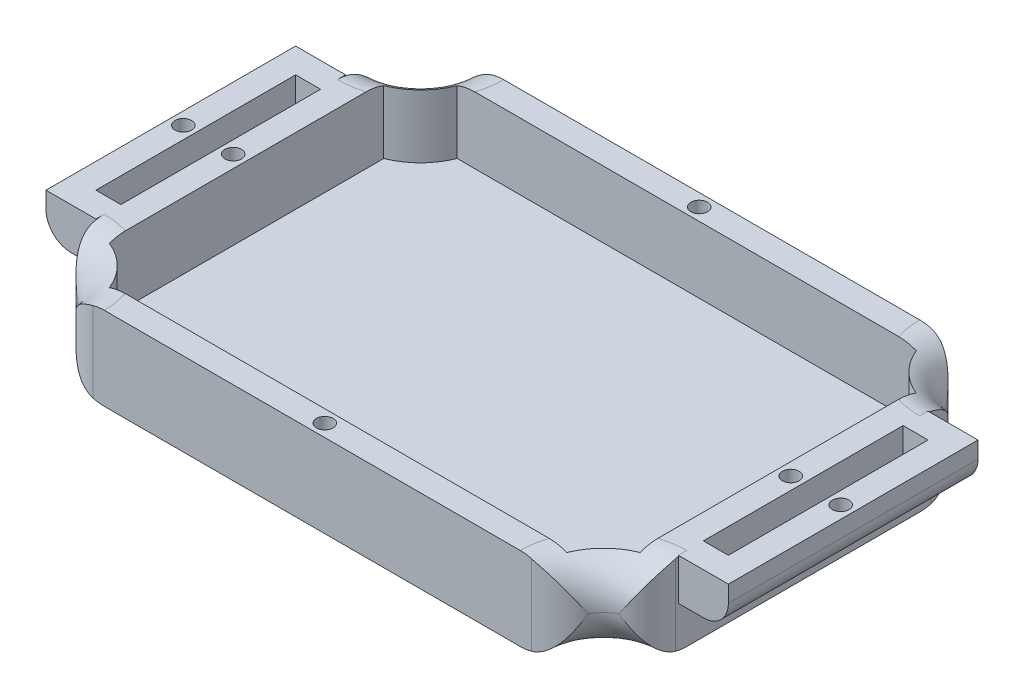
SolidWorks part; units mm, degrees
ref_plane "Front Plane" through (0, 0, 0) normal (0, 0, 1) x (1, 0, 0)
ref_plane "Top Plane" through (0, 0, 0) normal (0, 1, 0) x (1, 0, 0)
ref_plane "Right Plane" through (0, 0, 0) normal (1, 0, 0) x (0, 0, -1)
sketch "Sketch1" plane through (0, 0, 0) normal (0, 1, 0) x (1, 0, 0)
  line L1 (30, 24) -> (-30, 24)
  line L2 (35, 19) -> (35, -19)
  line L3 (30, -24) -> (-30, -24)
  line L4 (-35, 19) -> (-35, -19)
  line L5 (35, 24) -> (-35, -24) construction
  line L6 (35, -24) -> (-35, 24) construction
  arc A0 (-35, 19) -> (-30, 24) centre (-35, 24) ccw
  arc A1 (30, 24) -> (35, 19) centre (35, 24) ccw
  arc A2 (-30, -24) -> (-35, -19) centre (-35, -24) ccw
  arc A3 (35, -19) -> (30, -24) centre (35, -24) ccw
  point P0 (0, 0)
  dimension "D1" = 70
  dimension "D2" = 48
extrude "Boss-Extrude1" add sketch "Sketch1" along normal blind 10
sketch "Sketch2" plane through (0, 10, 0) normal (0, 1, 0) x (1, 0, 0)
  line L0 (-27.5838, 21) -> (27.5838, 21)
  line L1 (32, 16.5838) -> (32, -16.5838)
  line L2 (-27.3874, -21) -> (27.5838, -21)
  line L3 (-32, 16.5838) -> (-32, -16.3874)
  line L4 (30, 24) -> (-30, 24) construction
  line L5 (-35, 19) -> (-35, -19) construction
  line L6 (35, -19) -> (35, 19) construction
  line L7 (-30, -24) -> (30, -24) construction
  arc A0 (-32, 16.5838) -> (-27.5838, 21) centre (-35, 24) ccw
  arc A1 (-27.3874, -21) -> (-32, -16.3874) centre (-35, -24) ccw
  arc A2 (27.5838, 21) -> (32, 16.5838) centre (35, 24) ccw
  arc A3 (32, -16.5838) -> (27.5838, -21) centre (35, -24) ccw
  arc A4 (-30, -24) -> (-35, -19) centre (-35, -24) ccw construction
  arc A5 (-35, 19) -> (-30, 24) centre (-35, 24) ccw construction
  arc A6 (30, 24) -> (35, 19) centre (35, 24) ccw construction
  arc A7 (35, -19) -> (30, -24) centre (35, -24) ccw construction
  dimension "D1" = 3
  dimension "D2" = 3
  dimension "D3" = 3
  dimension "D4" = 3
extrude "Cut-Extrude1" cut sketch "Sketch2" against normal blind 8
fillet "Fillet1" radius 5 16 edges at (35, 5, -19) (31.4645, 10, -20.4645) (30, 5, -24) (31.4645, 0, -20.4645) (-30, 5, -24) (-31.4645, 10, -20.4645) (-35, 5, -19) (-31.4645, 0, -20.4645) (30, 5, 24) (31.4645, 10, 20.4645) (35, 5, 19) (31.4645, 0, 20.4645) (-35, 5, 19) (-31.4645, 10, 20.4645) (-30, 5, 24) (-31.4645, 0, 20.4645)
sketch "Sketch3" plane through (0, 10, 0) normal (0, 1, 0) x (1, 0, 0)
  line L0 (0, 0) -> (-43.0713, 0) construction
  line L1 (0, 0) -> (48.1157, 0) construction
  line L2 (-33.5, 5.6911) -> (-33.5, -7.6312) construction
  line L3 (33.5, 5.6911) -> (33.5, -7.6312) construction
  line L4 (0, 0) -> (0, -29.4902) construction
  line L5 (0, 0) -> (0, 28.1968) construction
  line L6 (-4.527, 22.5) -> (5.3031, 22.5) construction
  line L7 (-4.527, -22.5) -> (6.9845, -22.5) construction
  line L8 (-35, 14) -> (-35, -14) construction
  line L9 (25, 24) -> (-25, 24) construction
  line L12 (32, -16.5838) -> (32, 16.5838) construction
  line L13 (-27.3874, -21) -> (27.5838, -21) construction
  circle A0 centre (-33.5, 0) radius 1
  circle A1 centre (0, 22.5) radius 1
  circle A2 centre (33.5, 0) radius 1
  circle A3 centre (0, -22.5) radius 1
  dimension "D1" = 1.5
  dimension "D2" = 1.5
  dimension "D3" = 1.5
  dimension "D4" = 1.5
extrude "Cut-Extrude2" cut sketch "Sketch3" against normal blind 5
sketch "Sketch4" plane through (0, 10, 0) normal (0, 1, 0) x (1, 0, 0)
  line L0 (35, -14) -> (35, 14) construction
  line L4 (35, 15) -> (35, 12)
  line L5 (35, 12) -> (35, 0)
  line L7 (-35, 14) -> (-35, -14) construction
  line L8 (-35, 15) -> (-41, 15)
  line L9 (-35, 15) -> (-35, -15)
  line L10 (-35, -15) -> (-41, -15)
  line L11 (-41, 15) -> (-41, -15)
  line L12 (-35, 15) -> (-41, -15) construction
  line L13 (-35, -15) -> (-41, 15) construction
  line L14 (0, 0) -> (-43.9534, 0) construction
  line L15 (0, 0) -> (53.124, 0) construction
  line L20 (35, 0) -> (35, -15)
  line L21 (41, 15) -> (35, 15)
  line L23 (-35, 12) -> (-38, 12)
  line L24 (-35, 12) -> (-35, -12)
  line L25 (-35, -12) -> (-38, -12)
  line L26 (-38, 12) -> (-38, -12)
  line L27 (-35, 12) -> (-38, -12) construction
  line L28 (-35, -12) -> (-38, 12) construction
  line L29 (41, 15) -> (41, -15)
  line L30 (41, -15) -> (35, -15)
  line L31 (35, 15) -> (35, -15)
  line L32 (41, 15) -> (35, -15) construction
  line L33 (41, -15) -> (35, 15) construction
  line L34 (35, 12) -> (38, 12)
  line L35 (35, 12) -> (35, -12)
  line L36 (35, -12) -> (38, -12)
  line L37 (38, 12) -> (38, -12)
  point P0 (38, 0)
  point P2 (38, 0)
  point P7 (-38, 0)
  point P14 (-38, 15)
  point P19 (38, 0)
  point P24 (-36.5, 0)
  point P29 (36.6175, 0)
  point P35 (38, 15)
  dimension "D1" = 6
  dimension "D2" = 30
  dimension "D3" = 3
  dimension "D4" = 3
  dimension "D5" = 15
  dimension "D6" = 15
  dimension "D7" = 3
  dimension "D8" = 6
  dimension "D9" = 3
  dimension "D10" = 0
  dimension "D11" = 3
extrude "Boss-Extrude2" add sketch "Sketch4" against normal blind 5 contours L26 L23 L9 L8 L11 L10 L25 | L34 L37 L36 L20 L30 L29 L21 L4 M30
sketch "Sketch5" plane through (0, 10, 0) normal (0, 1, 0) x (1, 0, 0)
  line L0 (0, 0) -> (-50.0004, 0) construction
  line L1 (-39.5, 7.2728) -> (-39.5, -6.6667) construction
  line L2 (0, 0) -> (52.8792, 0) construction
  line L3 (39.5, 8.6364) -> (39.5, -6.6667) construction
  line L4 (-41, 15) -> (-41, -15) construction
  line L5 (41, 15) -> (41, -15) construction
  circle A0 centre (-39.5, 0) radius 1
  circle A1 centre (39.5, 0) radius 1
  dimension "D1" = 1.5
  dimension "D2" = 1.5
extrude "Cut-Extrude3" cut sketch "Sketch5" against normal blind 2
fillet "Fillet2" radius 3 1 edges at (41, 5, 0)
fillet "Fillet3" radius 3 1 edges at (-41, 5, 0)
